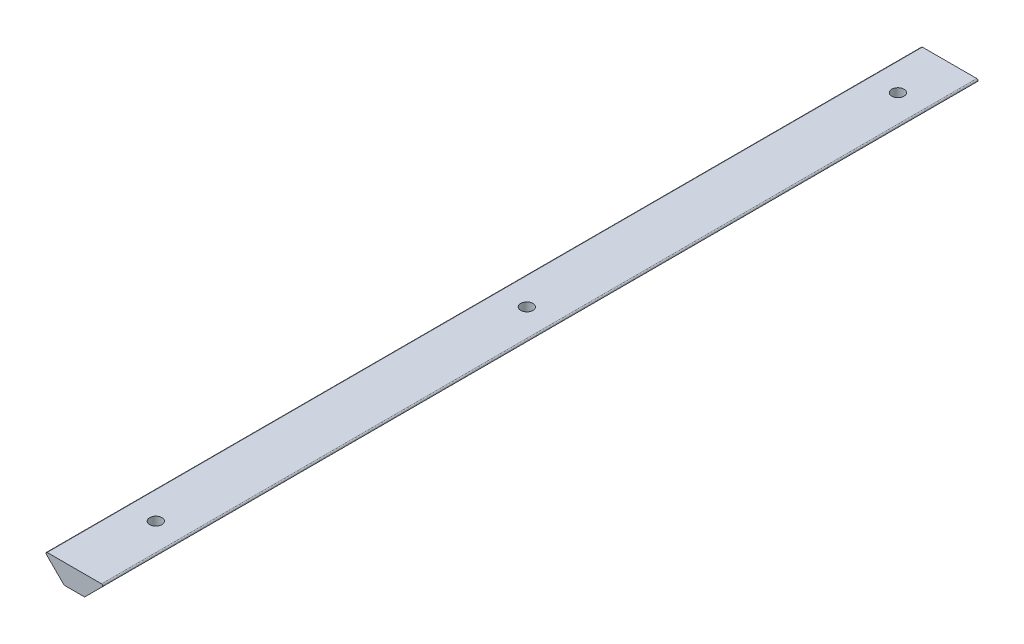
SolidWorks part; units mm, degrees
ref_plane "Front Plane" through (0, 0, 0) normal (0, 0, 1) x (1, 0, 0)
ref_plane "Top Plane" through (0, 0, 0) normal (0, 1, 0) x (1, 0, 0)
ref_plane "Right Plane" through (0, 0, 0) normal (1, 0, 0) x (0, 0, -1)
sketch "Sketch1" plane through (0, 0, 0) normal (0, 0, 1) x (1, 0, 0)
  line L0 (-6.6716, 8.9393) -> (-2.88, 8.9393) construction
  line L1 (6.6716, 8.9393) -> (2.88, 8.9393) construction
  line L2 (2.5993, 3.66) -> (7.0251, 8.0858) construction
  line L3 (2.5993, 3.66) -> (-2.5993, 3.66) construction
  line L4 (-2.5993, 3.66) -> (-7.0251, 8.0858) construction
  line L5 (-6.6716, 8.9393) -> (2.88, 8.9393)
  line L6 (6.6716, 8.9393) -> (2.88, 8.9393)
  line L7 (2.5993, 3.66) -> (7.0251, 8.0858)
  line L8 (2.5993, 3.66) -> (-2.5993, 3.66)
  line L9 (-2.5993, 3.66) -> (-7.0251, 8.0858) construction
  line L10 (2.5165, 3.86) -> (-2.5165, 3.86)
  line L11 (-2.5165, 3.86) -> (-6.8837, 8.2272)
  line L12 (-6.6716, 8.7393) -> (2.88, 8.7393)
  line L13 (6.6716, 8.7393) -> (2.88, 8.7393)
  line L14 (2.5165, 3.86) -> (6.8837, 8.2272)
  arc A0 (-6.6716, 8.9393) -> (-7.0251, 8.0858) centre (-6.6716, 8.4393) ccw construction
  arc A1 (7.0251, 8.0858) -> (6.6716, 8.9393) centre (6.6716, 8.4393) ccw construction
  arc A2 (-6.6716, 8.9393) -> (-7.0251, 8.0858) centre (-6.6716, 8.4393) ccw
  arc A3 (7.0251, 8.0858) -> (6.6716, 8.9393) centre (6.6716, 8.4393) ccw
  arc A4 (-6.6716, 8.7393) -> (-6.8837, 8.2272) centre (-6.6716, 8.4393) ccw
  arc A5 (6.8837, 8.2272) -> (6.6716, 8.7393) centre (6.6716, 8.4393) ccw
  dimension "D1" = 0.2
extrude "Boss-Extrude1" add sketch "Sketch1" against normal blind 215 contours L14 A5 L13 L12 A4 L11 L10
ref_plane "Plane2" through (0, 0, -202.3) normal (0, 0, -1) x (-1, 0, 0)
sketch "Sketch4" plane through (0, 8.7393, 0) normal (0, 1, 0) x (1, 0, 0)
  line L0 (0, 215) -> (0, 0) construction
  line L2 (-2.575, 0) -> (2.575, 0)
  line L3 (-2.575, 0) -> (-2.575, 215)
  line L4 (-6.6716, 0) -> (6.6716, 0)
  line L5 (6.6716, 0) -> (6.6716, 215)
  line L6 (6.6716, 215) -> (-6.6716, 215)
  line L7 (-6.6716, 215) -> (-6.6716, 0)
  line L8 (-6.6716, 0) -> (6.6716, 0) construction
  line L9 (6.6716, 0) -> (6.6716, 215) construction
  line L10 (6.6716, 215) -> (-6.6716, 215) construction
  line L11 (-6.6716, 215) -> (-6.6716, 0) construction
  line L12 (-2.575, 215) -> (2.575, 215)
  line L13 (2.575, 0) -> (2.575, 215)
  line L14 (-2.575, 0) -> (2.575, 215) construction
  line L15 (-2.575, 215) -> (2.575, 0) construction
  line L18 (-2.575, 107.5) -> (2.575, 107.5) construction
  point P6 (0, 107.5)
  dimension "D2" = 5.15
  dimension "D1" = 0
sketch "Sketch5" plane through (0, 8.7393, 0) normal (0, 1, 0) x (1, 0, 0)
  line L1 (6.6716, 0) -> (-6.6716, 0) construction
  line L2 (6.6716, 0) -> (-6.6716, 0) construction
  line L3 (0, 0) -> (0, 9.543) construction
  circle A0 centre (0, 20) radius 1.5
  dimension "D1" = 3
  dimension "D2" = 20
  dimension "D3" = 6.6716
extrude "Cut-Extrude1" cut sketch "Sketch5" against normal blind 30.226
pattern_linear "LPattern1" count 3 spacing 91.15 along (0, 0, -1) of "Cut-Extrude1"
